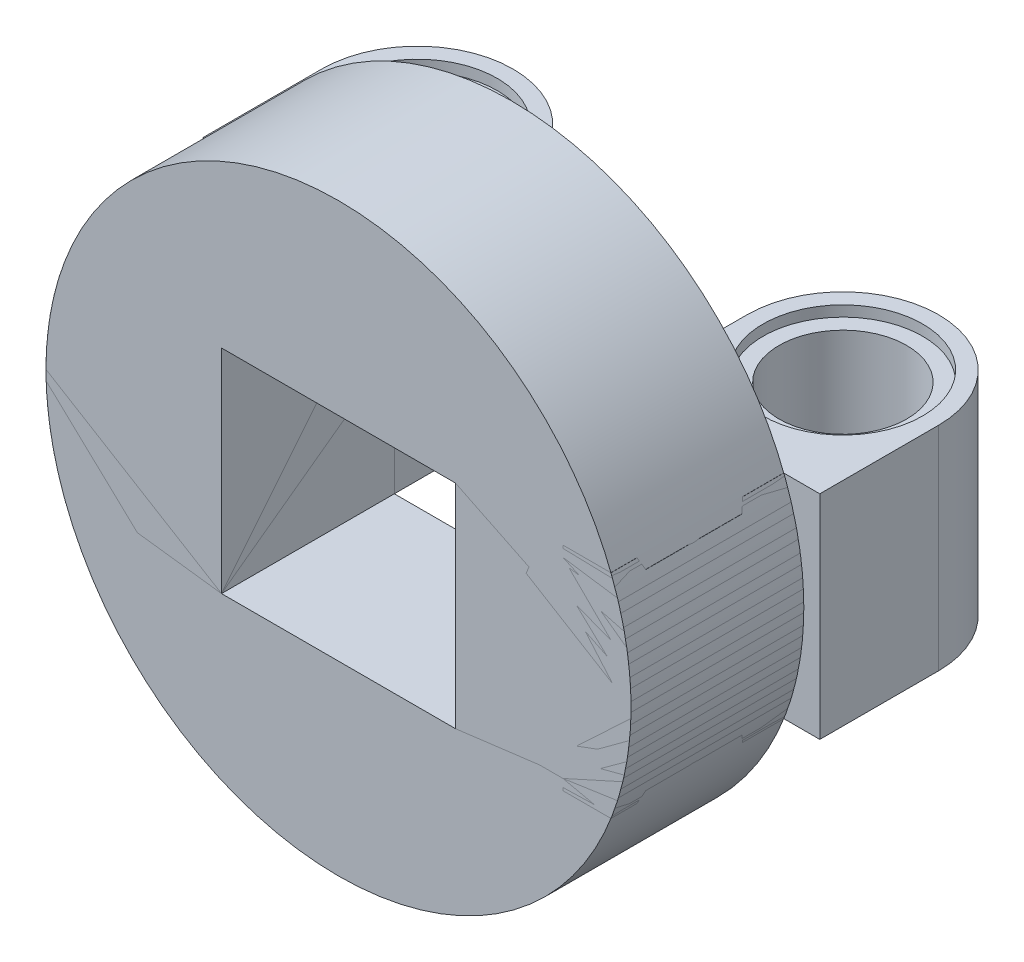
SolidWorks part; units mm, degrees
ref_plane "정면" through (0, 0, 0) normal (0, 0, 1) x (1, 0, 0)
ref_plane "윗면" through (0, 0, 0) normal (0, 1, 0) x (1, 0, 0)
ref_plane "우측면" through (0, 0, 0) normal (1, 0, 0) x (0, 0, -1)
imported_body "턴테이블 2-1-solid1"
imported_body "파트2-1-solid1"
imported_body "파트2-2-solid1"
sketch "스케치3" plane through (0, 0, 0) normal (1, 0, 0) x (0, 0, -1)
  line L0 (14.3632, 0) -> (-14.594, 0) construction
  line L1 (-3.5325, 16.3456) -> (3.5325, 16.3456)
  line L2 (-3.5325, 16.3456) -> (-3.5325, 11)
  line L3 (-3.5325, 11) -> (3.5325, 11)
  line L4 (3.5325, 16.3456) -> (3.5325, 11)
  line L5 (-3.5325, 16.3456) -> (3.5325, 11) construction
  line L6 (-3.5325, 11) -> (3.5325, 16.3456) construction
  point P0 (0, 13.6728)
  dimension "D1" = 5.3456
revolve "컷-회전1" cut sketch "스케치3" angle 360 about L0
sketch "스케치4" plane through (0, 0, 0) normal (0, 1, 0) x (1, 0, 0)
  line L1 (-11.6, -3.5325) -> (13.6435, -3.5325)
  line L2 (-11.6, -3.5325) -> (-11.6, -12.0969)
  line L3 (-11.6, -12.0969) -> (13.6435, -12.0969)
  line L4 (13.6435, -3.5325) -> (13.6435, -12.0969)
extrude "컷-돌출1" cut sketch "스케치4" against normal through all both and the other way through all
sketch "스케치5" plane through (0, 0, 3.5325) normal (0, 0, 1) x (1, 0, 0)
  line L1 (-4.4, -4) -> (4.4, -4)
  line L2 (-4.4, -4) -> (-4.4, 4)
  line L3 (-4.4, 4) -> (4.4, 4)
  line L4 (4.4, -4) -> (4.4, 4)
  line L5 (-4.4, -4) -> (4.4, 4) construction
  line L6 (-4.4, 4) -> (4.4, -4) construction
  point P0 (0, 0)
  dimension "D1" = 8.8
  dimension "D2" = 8
extrude "컷-돌출2" cut sketch "스케치5" against normal blind 10
sketch "스케치6" plane through (0, 0, 3.5325) normal (0, 0, 1) x (1, 0, 0)
  circle A0 centre (0, 0) radius 11
extrude "컷-돌출3" cut sketch "스케치6" against normal blind 0.565
